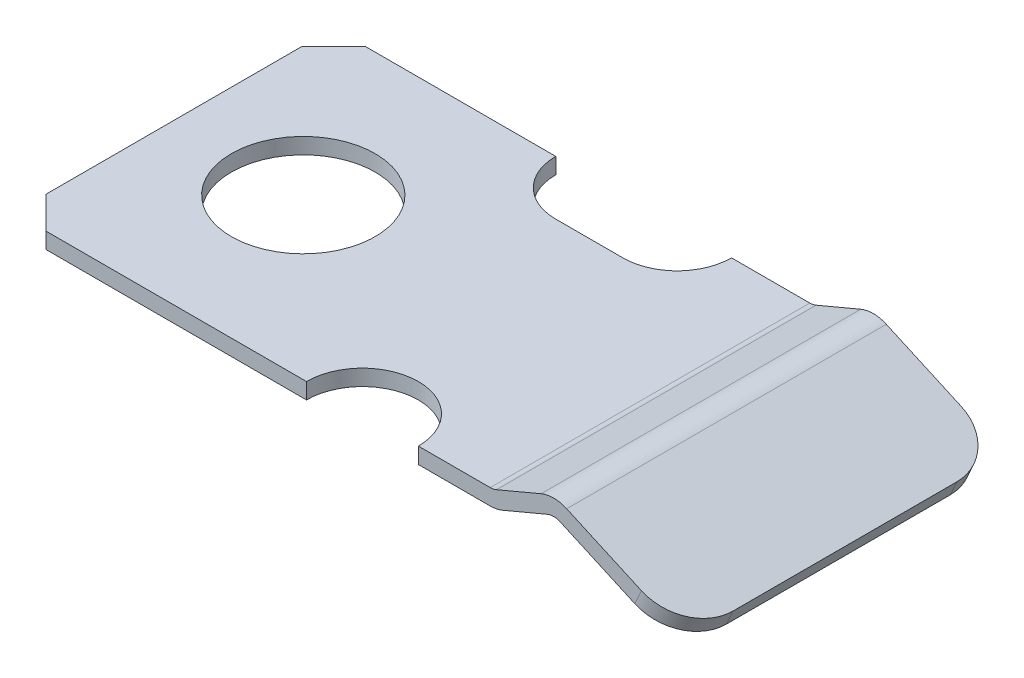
SolidWorks part; units mm, degrees
ref_plane "Plan de face" through (0, 0, 0) normal (0, 0, 1) x (1, 0, 0)
ref_plane "Plan de dessus" through (0, 0, 0) normal (0, 1, 0) x (1, 0, 0)
ref_plane "Plan de droite" through (0, 0, 0) normal (1, 0, 0) x (0, 0, -1)
sketch "Esquisse1" plane through (0, 0, 0) normal (0, 0, 1) x (1, 0, 0)
  line L0 (15.2877, 0.0787) -> (16.6883, 0.67)
  line L1 (0, 0) -> (14.8988, 0)
  line L2 (0, 0) -> (0, 0.5)
  line L3 (0, 0.5) -> (14.8988, 0.5)
  line L5 (17.0876, 0.6654) -> (20.7951, -1)
  line L6 (20.7951, -1) -> (21, -0.5439)
  line L7 (21, -0.5439) -> (17.2925, 1.1215)
  line L8 (16.4938, 1.1306) -> (15.0932, 0.5394)
  arc A0 (14.8988, 0.5) -> (15.0932, 0.5394) centre (14.8988, 1) ccw
  arc A1 (16.6883, 0.67) -> (17.0876, 0.6654) centre (16.8827, 0.2093) cw
  arc A2 (14.8988, 0) -> (15.2877, 0.0787) centre (14.8988, 1) ccw
  arc A3 (16.4938, 1.1306) -> (17.2925, 1.1215) centre (16.8827, 0.2093) cw
  point P10 (15, 0.5)
  point P18 (16.8951, 1.3)
  dimension "D9" = 0.5
  dimension "D10" = 1
  dimension "D1" = 0.5
  dimension "D2" = 0.5
  dimension "D3" = 0.5
  dimension "D4" = 21
  dimension "D5" = 15
  dimension "D6" = 1.3
  dimension "D7" = 2.3
  dimension "D8" = 4.5
extrude "Extrusion1" add sketch "Esquisse1" along normal mid plane 10
sketch "Esquisse2" plane through (0, 0.5, 0) normal (0, 1, 0) x (-1, 0, 0)
  line L0 (-14.8988, 5) -> (0, 5) construction
  line L1 (-14.8988, -5) -> (0, -5) construction
  line L2 (0, 5) -> (0, -5) construction
  line L3 (-10.75, -3.3) -> (-8.65, -3.3)
  line L4 (-12.45, -5) -> (-6.95, -5)
  circle A0 centre (-4.05, 0) radius 2.25
  circle A1 centre (-10.9, 5) radius 1.75
  arc A2 (-10.75, -3.3) -> (-12.45, -5) centre (-10.75, -5) ccw
  arc A3 (-6.95, -5) -> (-8.65, -3.3) centre (-8.65, -5) ccw
  point P6 (-1.8, 0)
  point P13 (-9.15, 5)
  point P14 (-10.75, -3.3)
  dimension "D1" = 4.5
  dimension "D4" = 3.5
  dimension "D2" = 1.8
  dimension "D3" = 9.15
  dimension "D5" = 1.7
  dimension "D6" = 5.5
  dimension "D7" = 10.75
  dimension "D8" = 4.05
extrude "Enlèv. mat.-Extru.1" cut sketch "Esquisse2" against normal blind 10
chamfer "Chanfrein1" distance 1 angle 45 2 edges at (0, 0.25, -5) (0, 0.25, 5)
fillet "Congé1" radius 1.5 2 edges at (20.8976, -0.772, -5) (20.8976, -0.772, 5)
